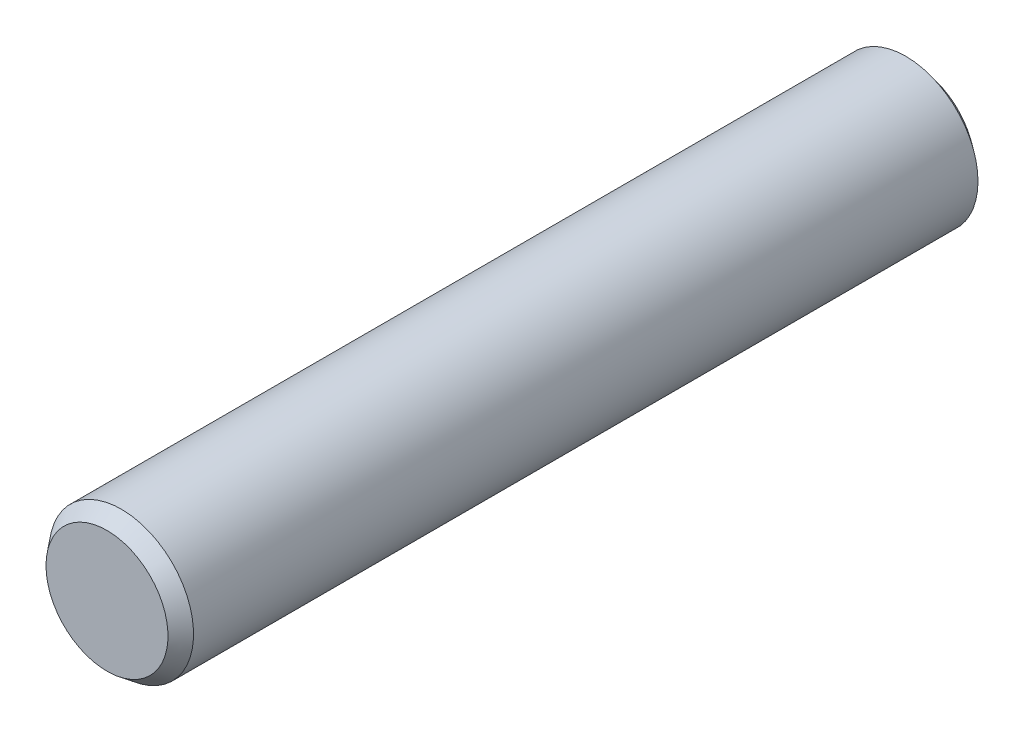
SolidWorks part; units mm, degrees
ref_plane "Front Plane" through (0, 0, 0) normal (0, 0, 1) x (1, 0, 0)
ref_plane "Top Plane" through (0, 0, 0) normal (0, 1, 0) x (1, 0, 0)
ref_plane "Right Plane" through (0, 0, 0) normal (1, 0, 0) x (0, 0, -1)
sketch "Sketch1" plane through (0, 0, 0) normal (0, 0, 1) x (1, 0, 0)
  circle A0 centre (0, 0) radius 3.9624
  dimension "D1" = 7.9248
extrude "Boss-Extrude1" add sketch "Sketch1" along normal blind 44.45
chamfer "Chamfer1" distance 0.7874 angle 38 2 edges at (3.9624, 0, 0) (3.9624, 0, 44.45)
